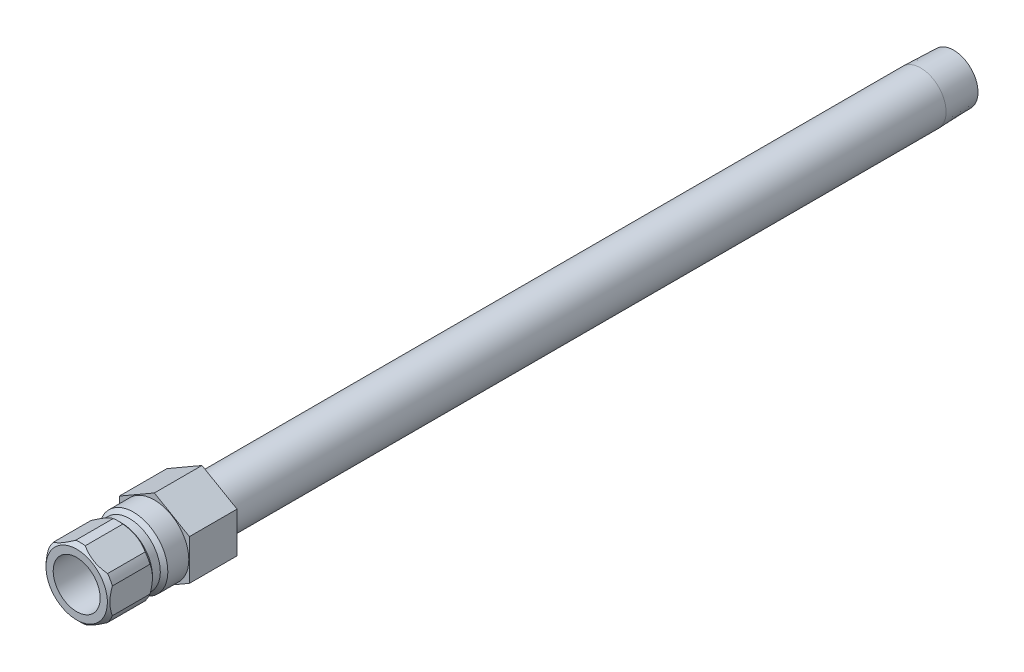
SolidWorks part; units mm, degrees
ref_plane "Front Plane" through (0, 0, 0) normal (0, 0, 1) x (1, 0, 0)
ref_plane "Top Plane" through (0, 0, 0) normal (0, 1, 0) x (1, 0, 0)
ref_plane "Right Plane" through (0, 0, 0) normal (1, 0, 0) x (0, 0, -1)
sketch "Sketch1" plane through (0, 0, 0) normal (1, 0, 0) x (0, 0, -1)
  line L0 (9.652, 0) -> (-18.923, 0) construction
  line L1 (-15.748, 4.7625) -> (-15.748, 6.223)
  line L2 (-6.604, 6.223) -> (-6.604, 0) construction
  line L3 (-14.986, 6.985) -> (-7.366, 6.985)
  line L4 (9.652, 5.1435) -> (9.652, 0) construction
  line L5 (-6.604, 6.223) -> (-5.0165, 6.223)
  line L6 (-4.2545, 6.985) -> (9.652, 6.985)
  line L7 (9.652, 6.985) -> (9.652, 5.1435)
  line L8 (-6.604, 6.223) -> (-7.366, 6.985)
  line L9 (-5.0165, 6.223) -> (-4.2545, 6.985)
  line L10 (-15.748, 6.223) -> (-14.986, 6.985)
  line L11 (-15.748, 4.7625) -> (-3.556, 4.7625)
  line L12 (9.652, 5.1435) -> (155.3718, 5.1435)
  line L13 (155.3718, 5.1435) -> (162.052, 4.9347)
  line L14 (162.052, 4.9347) -> (162.052, 3.4163)
  line L15 (-3.556, 4.7625) -> (-3.556, 6.985) construction
  line L16 (9.652, 6.731) -> (9.652, 0) construction
  line L17 (-3.556, 4.7625) -> (-2.8402, 3.4163)
  line L19 (-2.8402, 3.4163) -> (162.052, 3.4163)
  dimension "D2" = 1.5875
  dimension "D3" = 0.762
  dimension "D4" = 45
  dimension "D5" = 9.144
  dimension "D6" = 45
  dimension "D7" = 1.79
  dimension "D8" = 6.6802
  dimension "D9" = 177.8
  dimension "D10" = 3.175
  dimension "D11" = 9.525
  dimension "D12" = 10.287
  dimension "D13" = 25.4
  dimension "D14" = 13.97
  dimension "D15" = 6.8326
  dimension "D16" = 15.748
  dimension "D17" = 12.192
  dimension "D18" = 118
revolve "Revolve1" add sketch "Sketch1" angle 360 about L0
sketch "Sketch2" plane through (0, 0, 0) normal (0, 0, 1) x (1, 0, 0)
  line L1 (-7.112, 4.1061) -> (-7.112, -4.1061)
  line L2 (-7.112, -4.1061) -> (0, -8.2122)
  line L3 (0, -8.2122) -> (7.112, -4.1061)
  line L4 (7.112, -4.1061) -> (7.112, 4.1061)
  line L5 (7.112, 4.1061) -> (0, 8.2122)
  line L6 (0, 8.2122) -> (-7.112, 4.1061)
  circle A0 centre (0, 0) radius 7.112 construction
  circle A1 centre (0, 0) radius 4.7625 construction
  circle A2 centre (0, 0) radius 4.7625
  dimension "D1" = 14.224
extrude "Boss-Extrude1" add sketch "Sketch2" against normal up to vertex (9.652 mm away)
sketch "Sketch3" plane through (0, 0, 0) normal (0, 0, 1) x (1, 0, 0)
  line L1 (6.477, 3.7395) -> (0, 7.479)
  line L2 (0, 7.479) -> (-6.477, 3.7395)
  line L3 (-6.477, 3.7395) -> (-6.477, -3.7395)
  line L4 (-6.477, -3.7395) -> (0, -7.479)
  line L5 (0, -7.479) -> (6.477, -3.7395)
  line L6 (6.477, -3.7395) -> (6.477, 3.7395)
  circle A0 centre (0, 0) radius 6.477 construction
  dimension "D1" = 12.954
extrude "Cut-Extrude1" cut sketch "Sketch3" along normal through all from vertex at 6.604 flip side to cut
